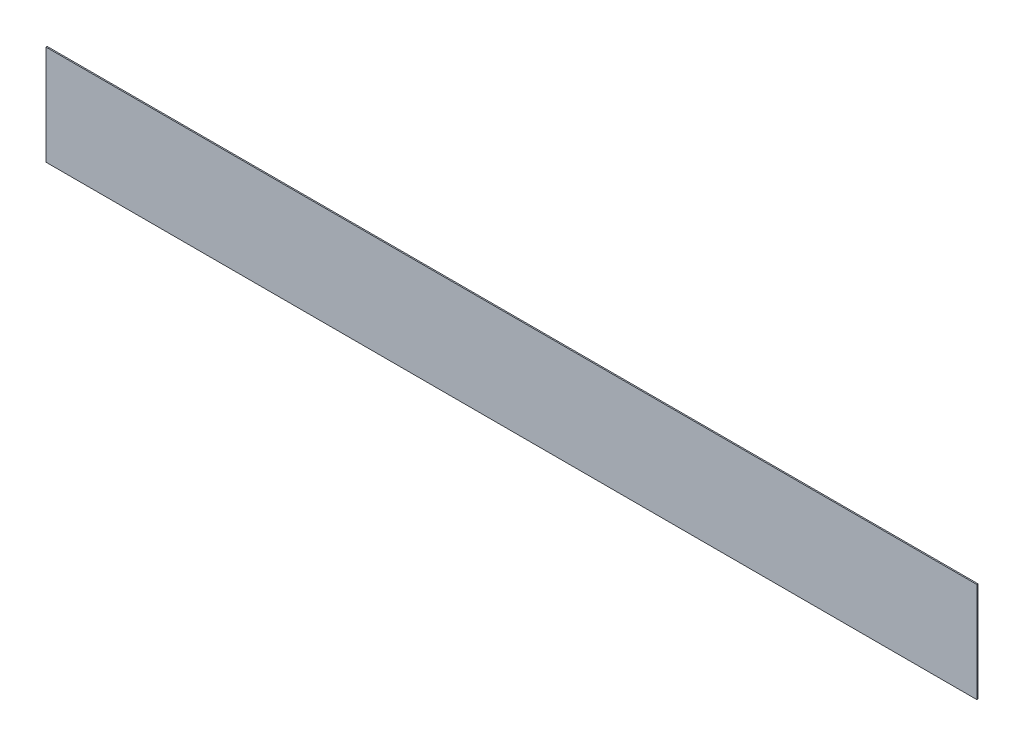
SolidWorks part; units mm, degrees
ref_plane "Plan de face" through (0, 0, 0) normal (0, 0, 1) x (1, 0, 0)
ref_plane "Plan de dessus" through (0, 0, 0) normal (0, 1, 0) x (1, 0, 0)
ref_plane "Plan de droite" through (0, 0, 0) normal (1, 0, 0) x (0, 0, -1)
sketch "Esquisse1" plane through (0, 0, 0) normal (0, 0, 1) x (1, 0, 0)
  line L1 (-118.1311, 38.8524) -> (1421.8689, 38.8524)
  line L2 (-118.1311, 38.8524) -> (-118.1311, -126.1476)
  line L3 (-118.1311, -126.1476) -> (1421.8689, -126.1476)
  line L4 (1421.8689, 38.8524) -> (1421.8689, -126.1476)
  dimension "D1" = 1540
  dimension "D2" = 165
extrude "Boss.-Extru.1" add sketch "Esquisse1" along normal blind 2
